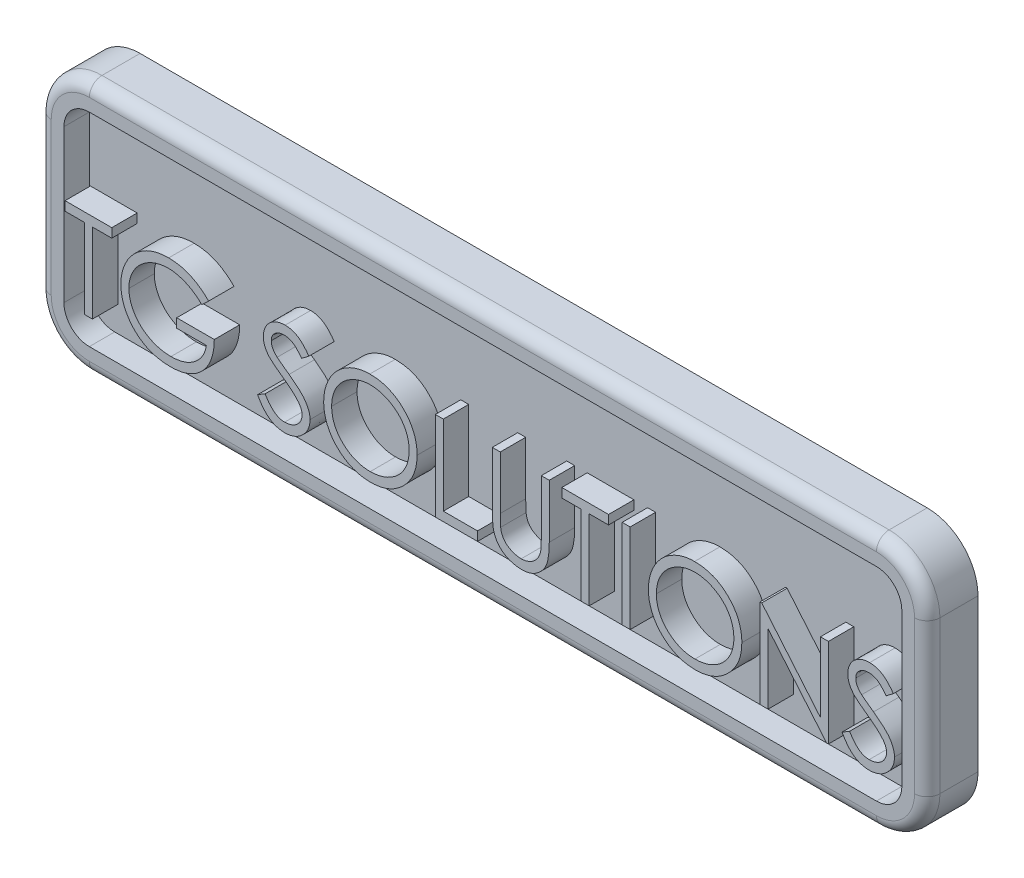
SolidWorks part; units mm, degrees
ref_plane "Front Plane" through (0, 0, 0) normal (0, 0, 1) x (1, 0, 0)
ref_plane "Top Plane" through (0, 0, 0) normal (0, 1, 0) x (1, 0, 0)
ref_plane "Right Plane" through (0, 0, 0) normal (1, 0, 0) x (0, 0, -1)
sketch "Sketch1" plane through (0, 0, 0) normal (0, 0, 1) x (1, 0, 0)
  line L1 (2, 0) -> (33, 0)
  line L2 (0, 2) -> (0, 8)
  line L3 (2, 10) -> (33, 10)
  line L4 (35, 2) -> (35, 8)
  arc A0 (33, 10) -> (35, 8) centre (33, 8) cw
  arc A1 (33, 0) -> (35, 2) centre (33, 2) ccw
  arc A2 (2, 0) -> (0, 2) centre (2, 2) cw
  arc A3 (0, 8) -> (2, 10) centre (2, 8) cw
  point P7 (35, 10)
  point P10 (35, 0)
  point P13 (0, 0)
  dimension "D3" = 2
  dimension "D1" = 35
  dimension "D2" = 10
extrude "Boss-Extrude1" add sketch "Sketch1" along normal blind 2
sketch "Sketch2" plane through (0, 0, 2) normal (0, 0, 1) x (1, 0, 0)
  line L0 (33, 9) -> (2, 9)
  line L1 (1, 8) -> (1, 2)
  line L2 (2, 1) -> (33, 1)
  line L3 (34, 2) -> (34, 8)
  line L4 (33, 10) -> (2, 10)
  line L5 (0, 8) -> (0, 2)
  line L6 (2, 0) -> (33, 0)
  line L7 (35, 2) -> (35, 8)
  line L16 (33, 10) -> (2, 10) construction
  line L17 (0, 8) -> (0, 2) construction
  line L18 (2, 0) -> (33, 0) construction
  line L19 (35, 2) -> (35, 8) construction
  arc A0 (2, 9) -> (1, 8) centre (2, 8) ccw
  arc A1 (1, 2) -> (2, 1) centre (2, 2) ccw
  arc A2 (33, 1) -> (34, 2) centre (33, 2) ccw
  arc A3 (34, 8) -> (33, 9) centre (33, 8) ccw
  arc A4 (35, 8) -> (33, 10) centre (33, 8) ccw
  arc A5 (2, 10) -> (0, 8) centre (2, 8) ccw
  arc A6 (0, 2) -> (2, 0) centre (2, 2) ccw
  arc A7 (33, 0) -> (35, 2) centre (33, 2) ccw
  arc A8 (35, 8) -> (33, 10) centre (33, 8) ccw construction
  arc A16 (2, 10) -> (0, 8) centre (2, 8) ccw construction
  arc A17 (0, 2) -> (2, 0) centre (2, 2) ccw construction
  arc A18 (33, 0) -> (35, 2) centre (33, 2) ccw construction
  dimension "D1" = 0
  dimension "D2" = 1
extrude "Cut-Extrude2" cut sketch "Sketch2" against normal blind 1
fillet "Fillet3" radius 0.5 8 edges at (34.4142, 0.5858, 2) (35, 5, 2) (34.4142, 9.4142, 2) (17.5, 0, 2) (0.5858, 0.5858, 2) (0, 5, 2) (0.5858, 9.4142, 2) (17.5, 10, 2)
sketch "Sketch3" plane through (0, 0, 1) normal (0, 0, 1) x (1, 0, 0)
  line L0 (1, 2) -> (34, 2) construction
  text T0 "TG SOLUTIONS"
extrude "Boss-Extrude2" add sketch "Sketch3" along normal blind 1
